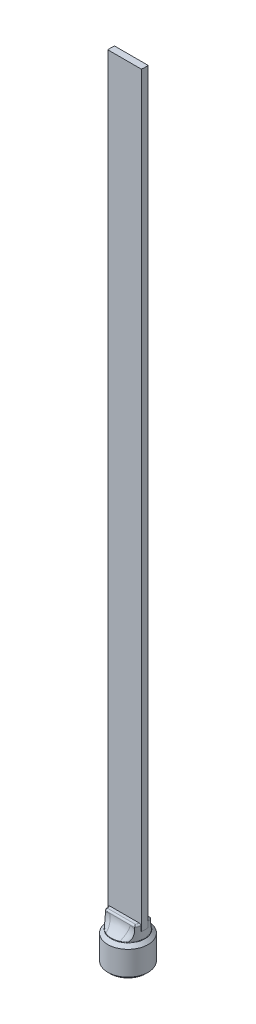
SolidWorks part; units mm, degrees
ref_plane "Front Plane" through (0, 0, 0) normal (0, 0, 1) x (1, 0, 0)
ref_plane "Top Plane" through (0, 0, 0) normal (0, 1, 0) x (1, 0, 0)
ref_plane "Right Plane" through (0, 0, 0) normal (1, 0, 0) x (0, 0, -1)
imported_body "Imported1"
sketch "Sketch1" plane through (0, 12.2428, 0) normal (0, 1, 0) x (1, 0, 0)
  line L0 (-5.4051, 1.0795) -> (5.4051, 1.0795)
  line L1 (5.4051, -1.0795) -> (-5.4051, -1.0795)
  line L2 (5.3014, 1.0795) -> (-5.3014, 1.0795) construction
  line L3 (-5.3014, -1.0795) -> (5.3014, -1.0795) construction
  arc A0 (5.4051, -1.0795) -> (5.4051, 1.0795) centre (0, 0) ccw
  arc A1 (-5.4051, 1.0795) -> (-5.4051, -1.0795) centre (0, 0) ccw
  dimension "D1" = 11.0236
extrude "Boss-Extrude1" add sketch "Sketch1" along normal offset from surface (241.7572 mm away) 254
